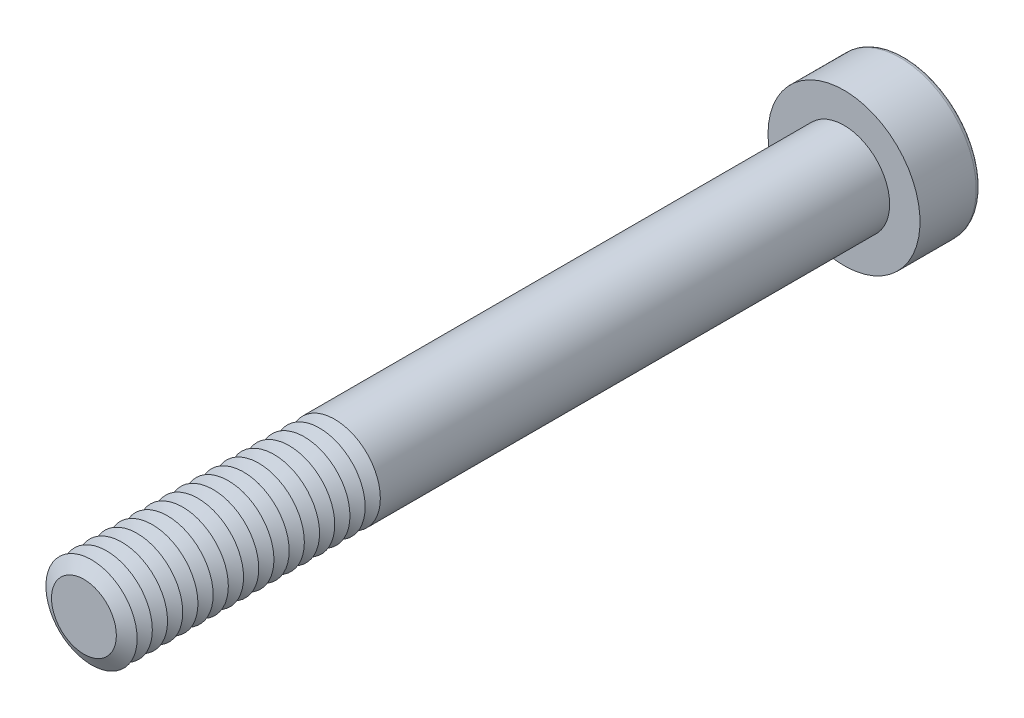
SolidWorks part; units mm, degrees
ref_plane "Front Plane" through (0, 0, 0) normal (0, 0, 1) x (1, 0, 0)
ref_plane "Top Plane" through (0, 0, 0) normal (0, 1, 0) x (1, 0, 0)
ref_plane "Right Plane" through (0, 0, 0) normal (1, 0, 0) x (0, 0, -1)
sketch "Sketch1" plane through (0, 0, 0) normal (0, 0, 1) x (1, 0, 0)
  circle A0 centre (0, 0) radius 3
  dimension "D1" = 6
extrude "Boss-Extrude1" add sketch "Sketch1" along normal blind 50
sketch "Sketch2" plane through (0, 0, 0) normal (0, 0, -1) x (-1, 0, 0)
  circle A0 centre (0, 0) radius 5
  dimension "D1" = 10
extrude "Boss-Extrude2" add sketch "Sketch2" along normal blind 4
sketch "Sketch3" plane through (0, 0, -4) normal (0, 0, -1) x (-1, 0, 0)
  line L1 (-1.1547, 2) -> (-2.3094, 0)
  line L2 (-2.3094, 0) -> (-1.1547, -2)
  line L3 (-1.1547, -2) -> (1.1547, -2)
  line L4 (1.1547, -2) -> (2.3094, 0)
  line L5 (2.3094, 0) -> (1.1547, 2)
  line L6 (1.1547, 2) -> (-1.1547, 2)
  circle A0 centre (0, 0) radius 2 construction
  dimension "D1" = 4
extrude "Cut-Extrude1" cut sketch "Sketch3" against normal blind 3
fillet "Fillet1" radius 0.3 1 edges at (-5, 0, -4)
sketch "Sketch4" plane through (0, 0, -1) normal (0, 0, -1) x (-1, 0, 0)
  line L0 (1.1547, -2) -> (2.3094, 0) construction
  circle A0 centre (0, 0) radius 2
extrude "Cut-Extrude2" cut sketch "Sketch4" against normal through all draft 60
sketch "Sketch5" plane through (0, 0, -4) normal (0, 0, -1) x (-1, 0, 0)
  circle A0 centre (0, 0) radius 2.3094
extrude "Cut-Extrude3" cut sketch "Sketch5" against normal through all draft 75
sketch "Sketch7" plane through (0, 0, 0) normal (1, 0, 0) x (0, 0, -1)
  line L25 (-50, 2.134) -> (-49.5, 3)
  line L26 (-50, 3) -> (-50, -3) construction
  line L27 (-49.5, 3) -> (-50.5, 3)
  line L28 (-50.5, 3) -> (-50, 2.134)
  line L29 (0, 3) -> (-50, 3) construction
  dimension "D1" = 1
revolve "Cut-Revolve1" cut sketch "Sketch7" angle 360 about axis through (0, 0, 50) along (0, 0, -1)
pattern_linear "LPattern1" count 17 spacing 1 along (0, 0, -1) of "Cut-Revolve1"
